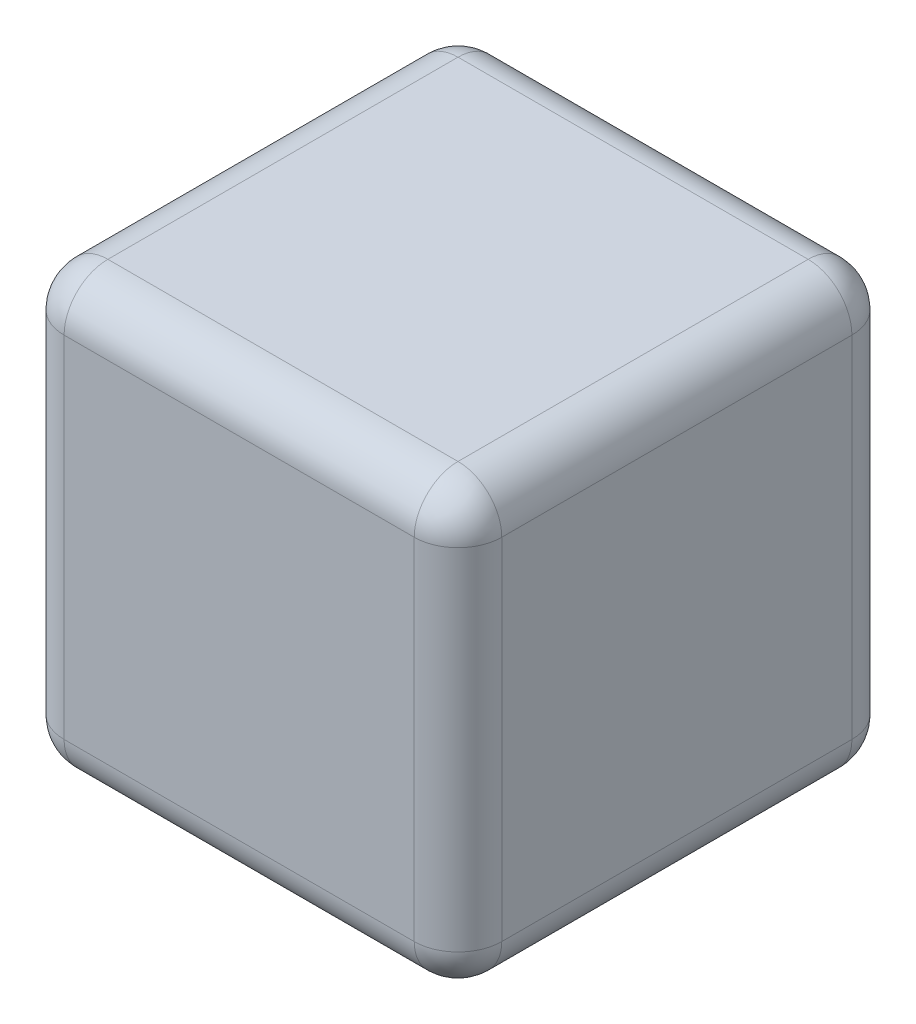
SolidWorks part; units mm, degrees
ref_plane "Front Plane" through (0, 0, 0) normal (0, 0, 1) x (1, 0, 0)
ref_plane "Top Plane" through (0, 0, 0) normal (0, 1, 0) x (1, 0, 0)
ref_plane "Right Plane" through (0, 0, 0) normal (1, 0, 0) x (0, 0, -1)
sketch "Sketch1" plane through (0, 0, 0) normal (0, 1, 0) x (1, 0, 0)
  line L1 (-2.5, 2.5) -> (2.5, 2.5)
  line L2 (-2.5, 2.5) -> (-2.5, -2.5)
  line L3 (-2.5, -2.5) -> (2.5, -2.5)
  line L4 (2.5, 2.5) -> (2.5, -2.5)
  line L5 (-2.5, 2.5) -> (2.5, -2.5) construction
  line L6 (-2.5, -2.5) -> (2.5, 2.5) construction
  point P0 (0, 0)
  dimension "D1" = 5
  dimension "D2" = 5
extrude "Boss-Extrude1" add sketch "Sketch1" along normal blind 5
fillet "Fillet1" radius 0.5 12 edges at (2.5, 2.5, -2.5) (-2.5, 2.5, -2.5) (0, 0, -2.5) (-2.5, 0, 0) (-2.5, 2.5, 2.5) (-2.5, 5, 0) (0, 5, -2.5) (2.5, 0, 0) (0, 0, 2.5) (2.5, 2.5, 2.5) (2.5, 5, 0) (0, 5, 2.5)
